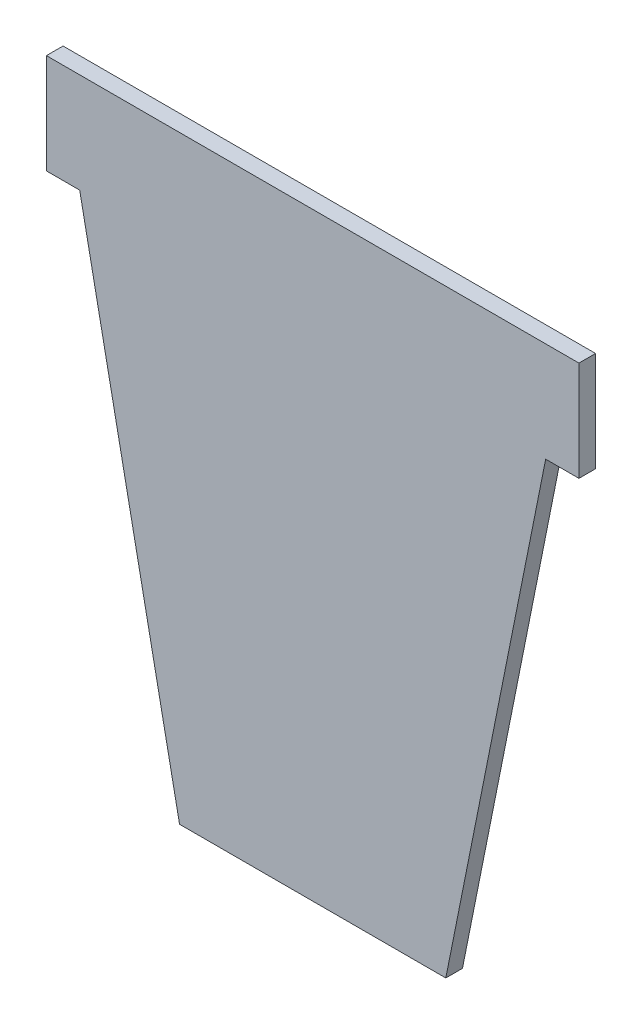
SolidWorks part; units mm, degrees
ref_plane "Front Plane" through (0, 0, 0) normal (0, 0, 1) x (1, 0, 0)
ref_plane "Top Plane" through (0, 0, 0) normal (0, 1, 0) x (1, 0, 0)
ref_plane "Right Plane" through (0, 0, 0) normal (1, 0, 0) x (0, 0, -1)
sketch "Sketch2" plane through (0, 0, 0) normal (0, 0, 1) x (1, 0, 0)
  line L0 (0, 0) -> (203.2, 0)
  line L1 (12.7, -38.1) -> (50.8, -228.6)
  line L2 (50.8, -228.6) -> (152.4, -228.6)
  line L3 (152.4, -228.6) -> (190.5, -38.1)
  line L4 (0, 0) -> (0, -38.1)
  line L5 (0, -38.1) -> (12.7, -38.1)
  line L6 (203.2, 0) -> (203.2, -38.1)
  line L7 (203.2, -38.1) -> (190.5, -38.1)
  point P3 (101.6, 0)
  point P6 (101.6, -228.6)
  dimension "D1" = 228.6
  dimension "D2" = 101.6
  dimension "D3" = 203.2
  dimension "D4" = 38.1
  dimension "D5" = 38.1
  dimension "D6" = 12.7
  dimension "D7" = 12.7
extrude "Boss-Extrude1" add sketch "Sketch2" along normal blind 6.35
